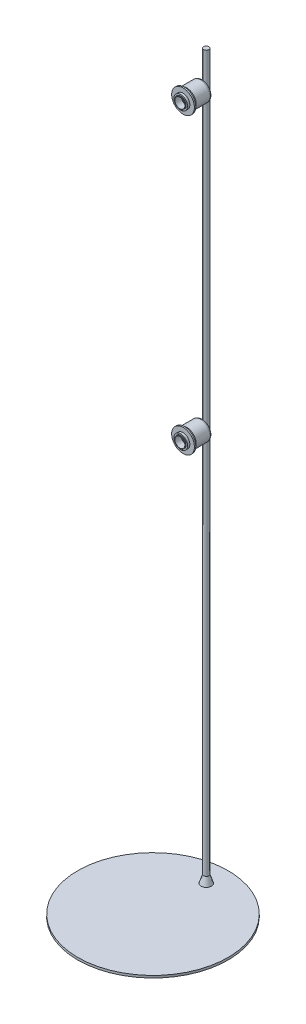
SolidWorks part; units mm, degrees
ref_plane "Alzado" through (0, 0, 0) normal (0, 0, 1) x (1, 0, 0)
ref_plane "Planta" through (0, 0, 0) normal (0, 1, 0) x (1, 0, 0)
ref_plane "Vista lateral" through (0, 0, 0) normal (1, 0, 0) x (0, 0, -1)
sketch "Croquis1" plane through (0, 0, 0) normal (0, 1, 0) x (1, 0, 0)
  circle A0 centre (0, 0) radius 165
  dimension "D1" = 330
extrude "Saliente-Extruir1" add sketch "Croquis1" along normal blind 5
sketch "Croquis2" plane through (0, 5, 0) normal (0, 1, 0) x (1, 0, 0)
  line L0 (0, 165) -> (0, 117)
  circle A0 centre (0, 0) radius 165 construction
  circle A1 centre (0, 117) radius 11.25
  dimension "D1" = 22.5
  dimension "D2" = 48
extrude "Saliente-Extruir2" add sketch "Croquis2" along normal blind 17 draft 18
sketch "Croquis3" plane through (0, 22, 0) normal (0, 1, 0) x (1, 0, 0)
  circle A0 centre (0, 117) radius 5.7264
extrude "Saliente-Extruir3" add sketch "Croquis3" along normal blind 1570
ref_plane "Plano1" through (0, 0, -117) normal (0, 0, 1) x (1, 0, 0)
sketch "Croquis4" plane through (0, 0, -117) normal (0, 0, 1) x (1, 0, 0)
  line L0 (0, 1592) -> (0, 872)
  line L1 (5.7264, 1592) -> (-5.7264, 1592) construction
  circle A0 centre (0, 872) radius 5
  dimension "D1" = 720
extrude "Saliente-Extruir4" add sketch "Croquis4" along normal blind 8 separate body
sketch "Croquis5" plane through (0, 0, -109) normal (0, 0, 1) x (1, 0, 0)
  circle A0 centre (0, 872) radius 21
extrude "Saliente-Extruir5" add sketch "Croquis5" along normal blind 35 separate body
fillet "Redondeo1" radius 5 1 edges at (21, 872, -109)
sketch "Croquis6" plane through (0, 0, -74) normal (0, 0, 1) x (1, 0, 0)
  circle A0 centre (0, 872) radius 12
extrude "Saliente-Extruir6" add sketch "Croquis6" along normal blind 15 separate body
ref_plane "Plano2" through (0, 0, -69) normal (0, 0, 1) x (1, 0, 0)
sketch "Croquis7" plane through (0, 0, -69) normal (0, 0, 1) x (1, 0, 0)
  circle A1 centre (0, 872) radius 25
  circle A2 centre (0, 872) radius 12
  dimension "D1" = 24
extrude "Saliente-Extruir7" add sketch "Croquis7" along normal blind 3 separate body
sketch "Croquis8" plane through (0, 0, -66) normal (0, 0, 1) x (1, 0, 0)
  circle A0 centre (0, 872) radius 12
  circle A1 centre (0, 872) radius 15
extrude "Saliente-Extruir8" add sketch "Croquis8" along normal blind 5
shell "Vaciado8" thickness 1
thread "Rosca1" pitch 1 start angle 0, offset 0, length 0, pitch 1, diameter 24
ref_plane "Plano3" through (12, 872, -74) normal (0, -1, 0) x (1, 0, 0)
sketch "Perfil de rosca1" plane through (12, 872, -74) normal (0, -1, 0) x (1, 0, 0)
  line L0 (0, 0) -> (0, 1) construction
  line L11 (0, 0) -> (0, 0.875)
  line L12 (0, 0.875) -> (-0.5413, 0.5625)
  line L13 (-0.5413, 0.5625) -> (-0.5413, 0.3125)
  line L15 (-0.5413, 0.3125) -> (0, 0)
  line L17 (-0.5413, 0.4375) -> (0, 0.4375) construction
  point P2 (0, 0)
  dimension "Pitch" = 1
  dimension "Profile_Angle" = 60
  dimension "Profile_Land" = 0.25
  dimension "Profile_Height" = 0.5413
thread "Rosca2" pitch 1 start angle 0, offset 0, length 0, pitch 1, diameter 24
ref_plane "Plano5" through (-12, 872, -61) normal (0, -1, 0) x (-1, 0, 0)
sketch "Perfil de rosca3" plane through (-12, 872, -61) normal (0, -1, 0) x (-1, 0, 0)
  line L0 (0, 0) -> (0, 1) construction
  line L11 (0, 0) -> (0, 0.875)
  line L12 (0, 0.875) -> (-0.5413, 0.5625)
  line L13 (-0.5413, 0.5625) -> (-0.5413, 0.3125)
  line L15 (-0.5413, 0.3125) -> (0, 0)
  line L17 (-0.5413, 0.4375) -> (0, 0.4375) construction
  point P2 (0, 0)
  dimension "Pitch" = 1
  dimension "Profile_Angle" = 60
  dimension "Profile_Land" = 0.25
  dimension "Profile_Height" = 0.5413
move or copy body "Sólido-Mover/Copiar1" bodies to move or copy 104 105 109 110 copy yes number of copies 1 translate (0, 645, 0)
